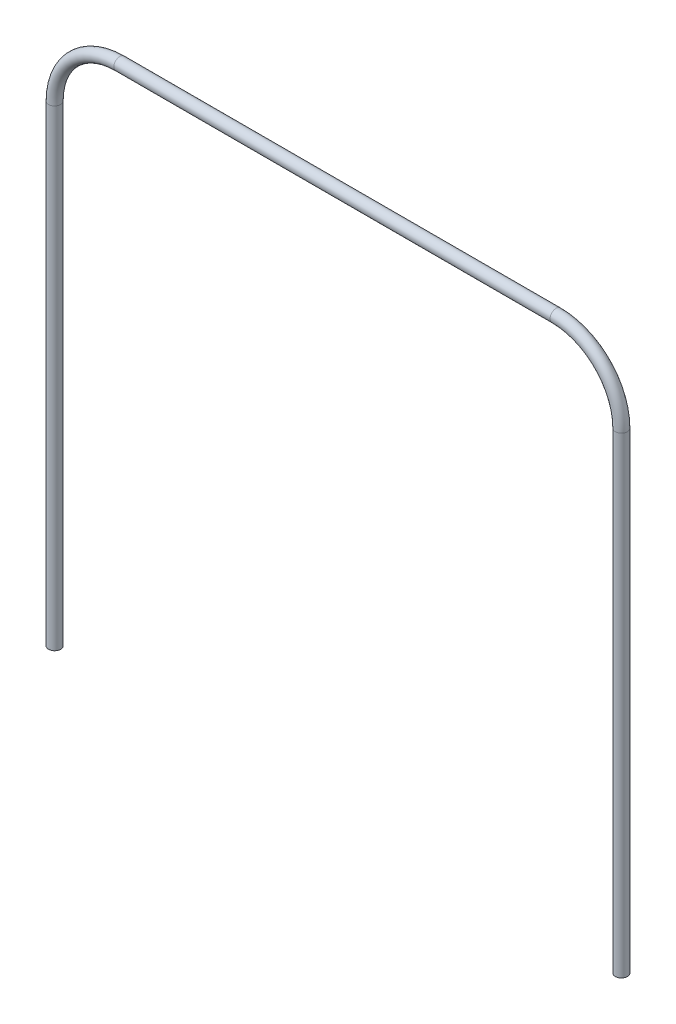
SolidWorks part; units mm, degrees
ref_plane "Plan1" through (0, 0, 0) normal (0, 0, 1) x (1, 0, 0)
ref_plane "Plan2" through (0, 0, 0) normal (0, 1, 0) x (1, 0, 0)
ref_plane "Plan3" through (0, 0, 0) normal (1, 0, 0) x (0, 0, -1)
sketch "Esquisse1" plane through (0, 0, 0) normal (0, 0, 1) x (1, 0, 0)
  line L0 (0, 0) -> (0, 470)
  line L1 (65, 535) -> (499.55, 535)
  line L2 (564.55, 470) -> (564.55, 0)
  arc A0 (499.55, 535) -> (564.55, 470) centre (499.55, 470) cw
  arc A1 (0, 470) -> (65, 535) centre (65, 470) cw
  point P7 (564.55, 535)
  point P10 (0, 535)
  dimension "D3" = 65
  dimension "D4" = 65
  dimension "D1" = 564.55
  dimension "D2" = 535
sketch "Esquisse2" plane through (0, 0, 0) normal (0, 1, 0) x (1, 0, 0)
  circle A0 centre (0, 0) radius 6
  dimension "D1" = 12
sweep "Base-Balayage" add profiles "Esquisse2" path "Esquisse1"
sketch "Esquisse3" plane through (0, 0, 0) normal (0, 0, 1) x (1, 0, 0)
  line L0 (499.55, 535) -> (65, 535) construction
  point P2 (282.275, 535)
